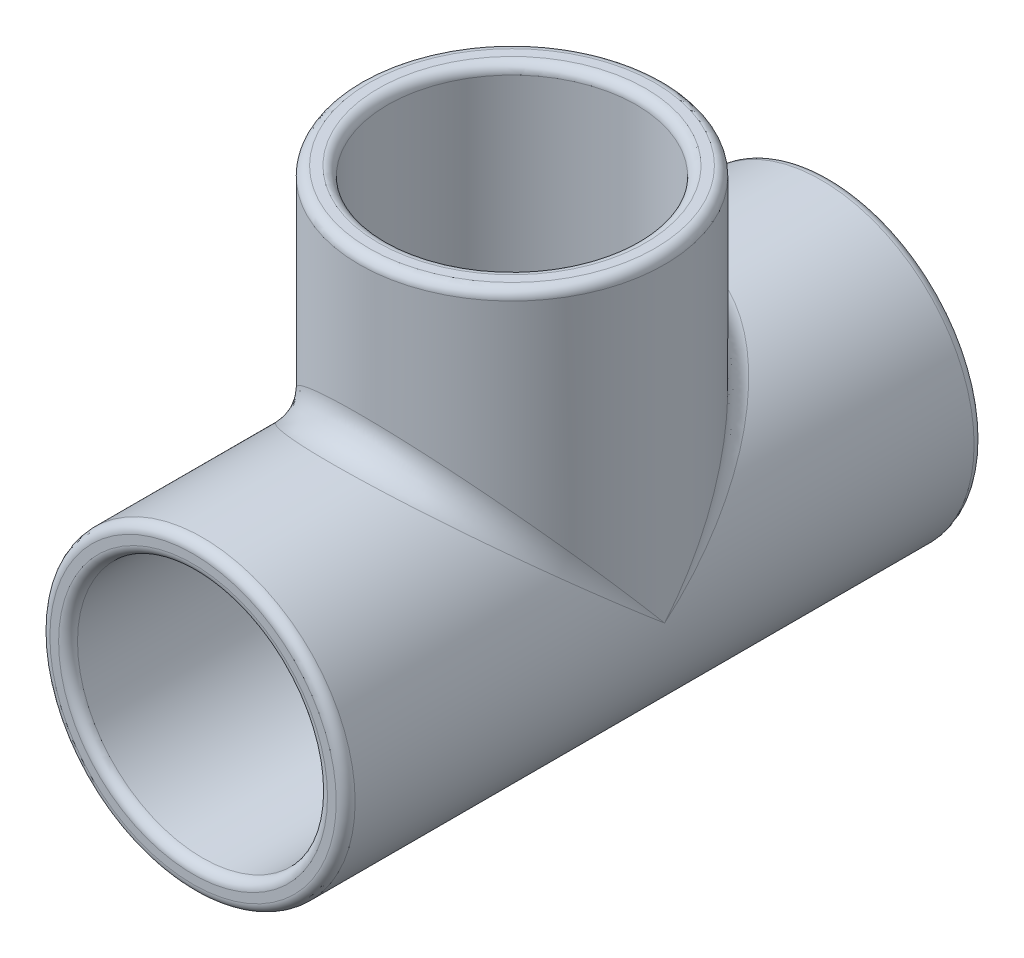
SolidWorks part; units mm, degrees
ref_plane "Front" through (0, 0, 0) normal (0, 0, 1) x (1, 0, 0)
ref_plane "Top" through (0, 0, 0) normal (0, 1, 0) x (1, 0, 0)
ref_plane "Right" through (0, 0, 0) normal (1, 0, 0) x (0, 0, -1)
sketch "Sketch1" plane through (0, 0, 0) normal (0, 0, 1) x (1, 0, 0)
  circle A0 centre (0, 0) radius 20.5105
  circle A1 centre (0, 0) radius 16.8021
  dimension "D1" = 41.021
  dimension "D2" = 33.6042
extrude "Extrude1" add sketch "Sketch1" along normal blind 85.725
sketch "Sketch2" plane through (0, 0, 0) normal (0, 1, 0) x (1, 0, 0)
  line L0 (20.5105, -85.725) -> (20.5105, 0) construction
  line L1 (20.5105, -85.725) -> (20.5105, 0) construction
  line L2 (-20.5105, 0) -> (-20.5105, -85.725) construction
  line L3 (-20.5105, 0) -> (-20.5105, -85.725) construction
  line L4 (20.5105, 0) -> (-20.5105, 0) construction
  circle A0 centre (0, -42.8625) radius 20.5105
  circle A1 centre (0, -42.8625) radius 16.7005
  dimension "D1" = 33.401
  dimension "D2" = 42.8625
extrude "Extrude2" add sketch "Sketch2" along normal blind 42.9895
sketch "Sketch4" plane through (0, 0, 85.725) normal (0, 0, 1) x (1, 0, 0)
  circle A0 centre (0, 0) radius 16.8021 construction
  circle A1 centre (0, 0) radius 16.8021
extrude "Cut-Extrude2" cut sketch "Sketch4" against normal blind 89.1794
sketch "Sketch5" plane through (0, 42.9895, 0) normal (0, 1, 0) x (-1, 0, 0)
  circle A0 centre (0, 42.8625) radius 16.7005 construction
  circle A1 centre (0, 42.8625) radius 16.7005
extrude "Cut-Extrude3" cut sketch "Sketch5" against normal blind 42.9895
sketch "Sketch8" plane through (0, 0, 0) normal (0, 0, 1) x (1, 0, 0)
  circle A0 centre (0, 0) radius 14.3479
  circle A1 centre (0, 0) radius 16.8853
extrude "Extrude3" add sketch "Sketch8" along normal blind 73.9394
sketch "Sketch9" plane through (0, 0, 0) normal (0, 0, -1) x (-1, 0, 0)
  circle A0 centre (0, 0) radius 16.8021
  dimension "D1" = 33.6042
extrude "Cut-Extrude4" cut sketch "Sketch9" against normal blind 25.4
sketch "Sketch10" plane through (0, 0, 85.725) normal (0, 0, 1) x (1, 0, 0)
  circle A1 centre (0, 0) radius 16.8021 construction
  circle A2 centre (0, 0) radius 16.8021
extrude "Cut-Extrude5" cut sketch "Sketch10" against normal blind 25.4
sketch "Sketch11" plane through (0, 42.9895, 0) normal (0, 1, 0) x (-1, 0, 0)
  circle A0 centre (0, 42.8625) radius 16.7005 construction
  circle A1 centre (0, 42.8625) radius 16.7005
extrude "Cut-Extrude6" cut sketch "Sketch11" against normal blind 42.9895
sketch "Sketch13" plane through (0, 0, 0) normal (0, 1, 0) x (1, 0, 0)
  circle A0 centre (0, -42.8625) radius 16.7005 construction
  circle A1 centre (0, -42.8625) radius 16.7005
  circle A2 centre (0, -42.8625) radius 13.82
extrude "Extrude4" add sketch "Sketch13" along normal blind 42.9895
sketch "Sketch15" plane through (0, 0, 0) normal (0, 0, -1) x (-1, 0, 0)
  circle A0 centre (0, 0) radius 14.3479 construction
  circle A1 centre (0, 0) radius 14.3479
extrude "Cut-Extrude8" cut sketch "Sketch15" against normal through all
sketch "Sketch16" plane through (0, 42.9895, 0) normal (0, 1, 0) x (1, 0, 0)
  circle A0 centre (0, -42.8625) radius 16.7005
extrude "Cut-Extrude9" cut sketch "Sketch16" against normal blind 25.4
fillet "Fillet1" radius 3.81 2 edges at (0, 20.5105, 63.373) (0, 20.5105, 22.352)
fillet "Fillet2" radius 1.27 6 edges at (-16.8021, 0, 0) (20.5105, 0, 0) (16.8021, 0, 85.725) (20.5105, 0, 85.725) (0, 42.9895, 63.373) (0, 42.9895, 59.563)
